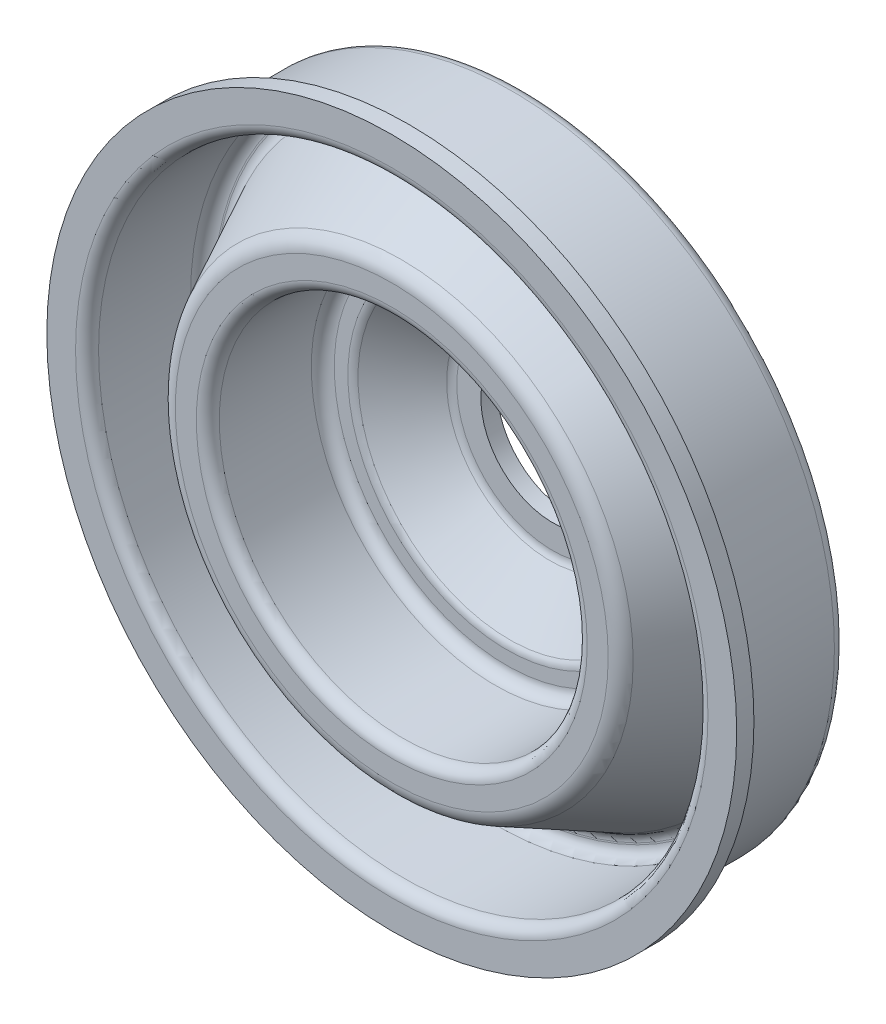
SolidWorks part; units mm, degrees
ref_plane "Plan de face" through (0, 0, 0) normal (0, 0, 1) x (1, 0, 0)
ref_plane "Plan de dessus" through (0, 0, 0) normal (0, 1, 0) x (1, 0, 0)
ref_plane "Plan de droite" through (0, 0, 0) normal (1, 0, 0) x (0, 0, -1)
sketch "Esquisse1" plane through (0, 0, 0) normal (1, 0, 0) x (0, 0, -1)
  line L0 (-5.1827, 13.1724) -> (-1.6547, 8.9952)
  line L1 (-3.6827, 13.6261) -> (-0.236, 9.5452)
  line L2 (-12.7757, 19.3944) -> (-4.7479, 23.4084)
  line L3 (-5.8374, 17.5) -> (-12.3285, 17.5)
  line L4 (-14.5895, 20.1666) -> (-5.9715, 24.4757)
  line L5 (-4.9187, 28) -> (-13.9187, 28)
  line L6 (-6.4187, 26.5) -> (-14.4187, 26.5)
  line L7 (-14.4187, 16) -> (-6.4187, 16)
  line L8 (-15.4187, 18.825) -> (-15.4187, 17)
  line L9 (-15.4187, 30) -> (-15.4187, 27.5)
  line L10 (-13.9187, 30) -> (-15.4187, 30)
  line L11 (-3.9187, 14.2714) -> (-3.9187, 15.5017)
  line L12 (-3.9187, 24.75) -> (-3.9187, 27)
  line L13 (-5.4187, 15) -> (-5.4187, 13.8176)
  line L14 (-13.9187, 28) -> (-13.9187, 30)
  line L15 (-5.4187, 25.5) -> (-5.4187, 25.3701)
  line L16 (-1.4187, 0) -> (1.1117, 0) construction
  line L17 (-1.4187, 6.25) -> (0, 6.25)
  line L32 (-1.4187, 6.25) -> (-1.4187, 8.35)
  line L33 (0, 6.25) -> (0, 8.9)
  line L34 (-15.4187, 18.825) -> (-15.4187, 17)
  arc A0 (0, 8.9) -> (-0.236, 9.5452) centre (-1, 8.9) ccw
  arc A1 (-1.4187, 8.35) -> (-1.6547, 8.9952) centre (-2.4187, 8.35) ccw
  arc A2 (-14.5895, 20.1666) -> (-15.4187, 18.825) centre (-13.9187, 18.825) ccw
  arc A3 (-12.7757, 19.3944) -> (-12.3285, 17.5) centre (-12.3285, 18.5) ccw
  arc A4 (-15.4187, 17) -> (-14.4187, 16) centre (-14.4187, 17) ccw
  arc A5 (-15.4187, 27.5) -> (-14.4187, 26.5) centre (-14.4187, 27.5) ccw
  arc A6 (-3.9187, 14.2714) -> (-3.6827, 13.6261) centre (-2.9187, 14.2714) ccw
  arc A7 (-3.9187, 15.5017) -> (-5.8374, 17.5) centre (-5.9187, 15.5017) ccw
  arc A8 (-3.9187, 27) -> (-4.9187, 28) centre (-4.9187, 27) ccw
  arc A9 (-5.4187, 25.5) -> (-6.4187, 26.5) centre (-6.4187, 25.5) ccw
  arc A10 (-5.9715, 24.4757) -> (-5.4187, 25.3701) centre (-6.4187, 25.3701) ccw
  arc A11 (-4.7479, 23.4084) -> (-3.9187, 24.75) centre (-5.4187, 24.75) ccw
  arc A12 (-5.4187, 13.8176) -> (-5.1827, 13.1724) centre (-4.4187, 13.8176) ccw
  arc A13 (-5.4187, 15) -> (-6.4187, 16) centre (-6.4187, 15) ccw
  dimension "D3" = 1
  dimension "D4" = 1.5
  dimension "D5" = 2
  dimension "D20" = 16.7
  dimension "D2" = 12.5
  dimension "D6" = 0.236
  dimension "D7" = 1.4187
  dimension "D8" = 2.9187
  dimension "D9" = 4.7479
  dimension "D10" = 12.3285
  dimension "D11" = 13.9187
  dimension "D12" = 32
  dimension "D13" = 53
  dimension "D14" = 60
  dimension "D15" = 56
  dimension "D16" = 35
  dimension "D17" = 5.8374
  dimension "D18" = 5.9187
  dimension "D19" = 17.8
  dimension "D21" = 37.65
revolve "Révolution2" add sketch "Esquisse1" angle 360 about L16
